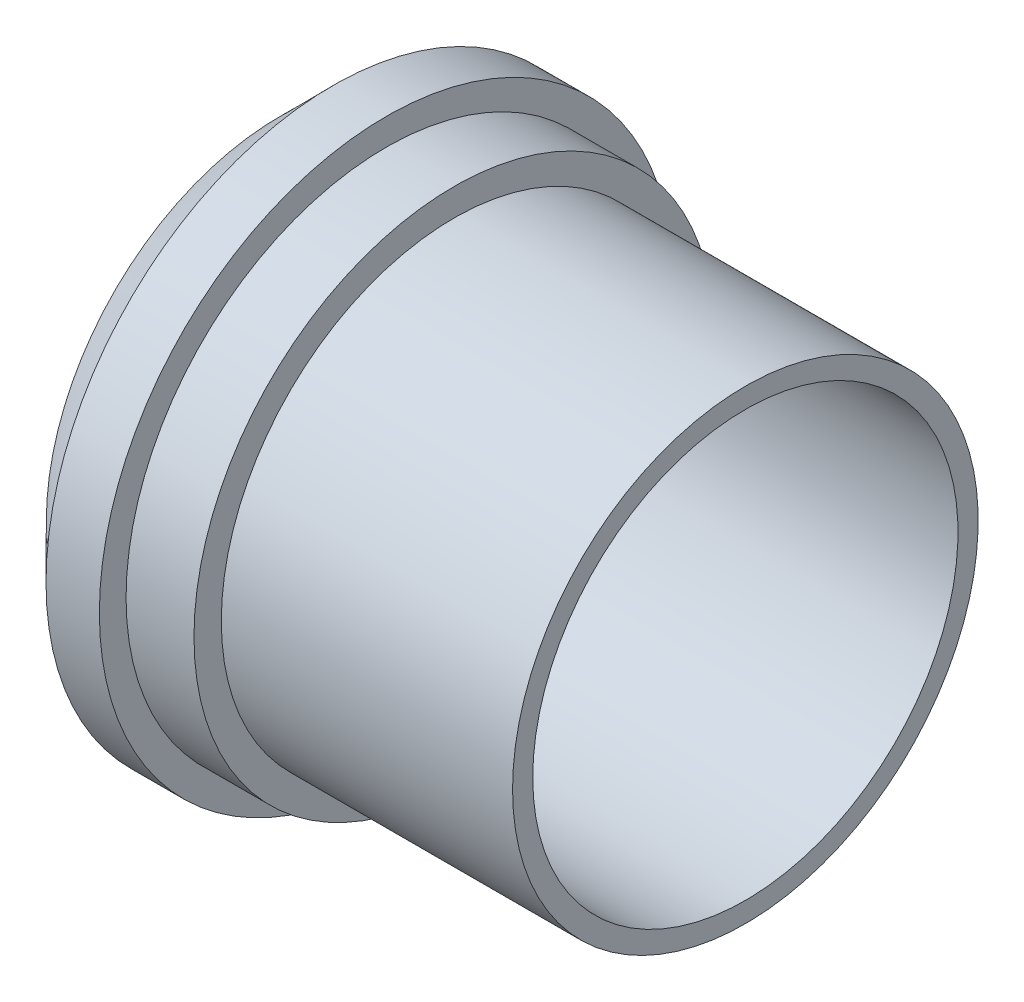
SolidWorks part; units mm, degrees
ref_plane "Front Plane" through (0, 0, 0) normal (0, 0, 1) x (1, 0, 0)
ref_plane "Top Plane" through (0, 0, 0) normal (0, 1, 0) x (1, 0, 0)
ref_plane "Right Plane" through (0, 0, 0) normal (1, 0, 0) x (0, 0, -1)
sketch "Sketch1" plane through (0, 0, 0) normal (0, 0, 1) x (1, 0, 0)
  line L0 (0, 0) -> (-23.8328, 0)
  line L1 (-23.8328, 0) -> (-23.8328, -2.2352)
  line L2 (-23.8328, -2.2352) -> (-29.3903, -2.2352)
  line L3 (-29.3903, -2.2352) -> (-29.3903, -4.4196)
  line L4 (-29.3903, -4.4196) -> (-33.7566, -4.4196)
  line L5 (-33.7566, -4.4196) -> (-38.1, -0.0508)
  line L6 (-38.1, -0.0508) -> (-38.1, 19.05)
  line L7 (-38.1, 19.05) -> (0, 19.05)
  line L8 (0, 19.05) -> (0, 0)
  dimension "D1" = 19.05
  dimension "D2" = 38.1
  dimension "D3" = 5.5575
  dimension "D4" = 4.3663
  dimension "D5" = 4.3434
  dimension "D6" = 19.1008
  dimension "D7" = 23.4696
  dimension "D8" = 21.2852
revolve "Revolve1" add sketch "Sketch1" angle 360 about L7
sketch "Sketch4" plane through (-38.1, 0, 0) normal (-1, 0, 0) x (0, 0, 1)
  circle A0 centre (0, 19.05) radius 17.399
extrude "Cut-Extrude1" cut sketch "Sketch4" against normal blind 38.1 contours A0
